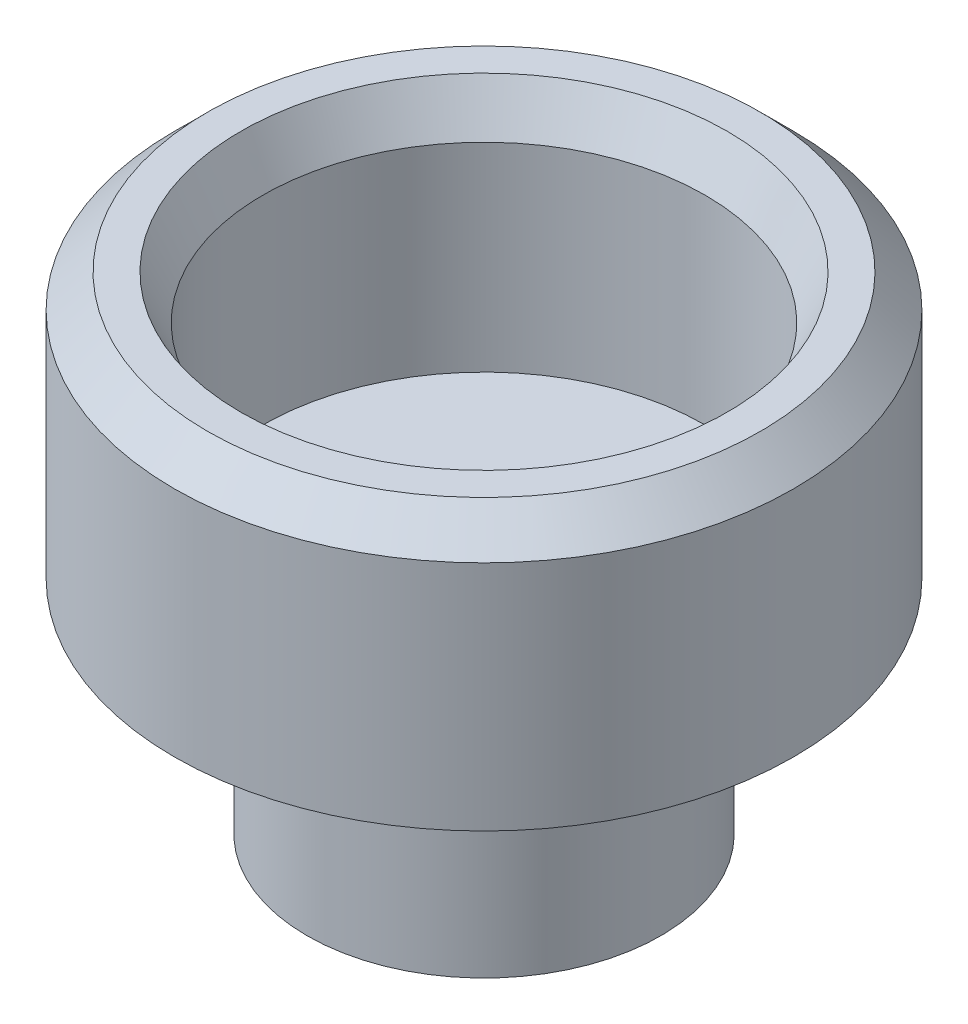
SolidWorks part; units mm, degrees
ref_plane "Přední rovina" through (0, 0, 0) normal (0, 0, 1) x (1, 0, 0)
ref_plane "Horní rovina" through (0, 0, 0) normal (0, 1, 0) x (1, 0, 0)
ref_plane "Pravá rovina" through (0, 0, 0) normal (1, 0, 0) x (0, 0, -1)
sketch "Skica1" plane through (0, 0, 0) normal (0, 1, 0) x (1, 0, 0)
  circle A0 centre (0, 0) radius 8
extrude "Přidat vysunutím1" add sketch "Skica1" along normal blind 10
sketch "Skica2" plane through (0, 10, 0) normal (0, 1, 0) x (-1, 0, 0)
  circle A0 centre (0, 0) radius 14
extrude "Přidat vysunutím2" add sketch "Skica2" along normal blind 12
chamfer "Zkosení1" distance 4 distance2 6 1 edges at (0, 10, 8)
chamfer "Zkosení2" distance 1.5 angle 45 1 edges at (0, 22, 14)
sketch "Skica3" plane through (0, 0, 0) normal (0, -1, 0) x (1, 0, 0)
  circle A0 centre (0, 0) radius 3.5
extrude "Odebrat vysunutím1" cut sketch "Skica3" against normal blind 11
sketch "Skica4" plane through (0, 22, 0) normal (0, 1, 0) x (1, 0, 0)
  circle A0 centre (0, 0) radius 10
extrude "Odebrat vysunutím2" cut sketch "Skica4" against normal blind 11
chamfer "Zkosení3" distance 1 distance2 2 1 edges at (0, 22, 10)
